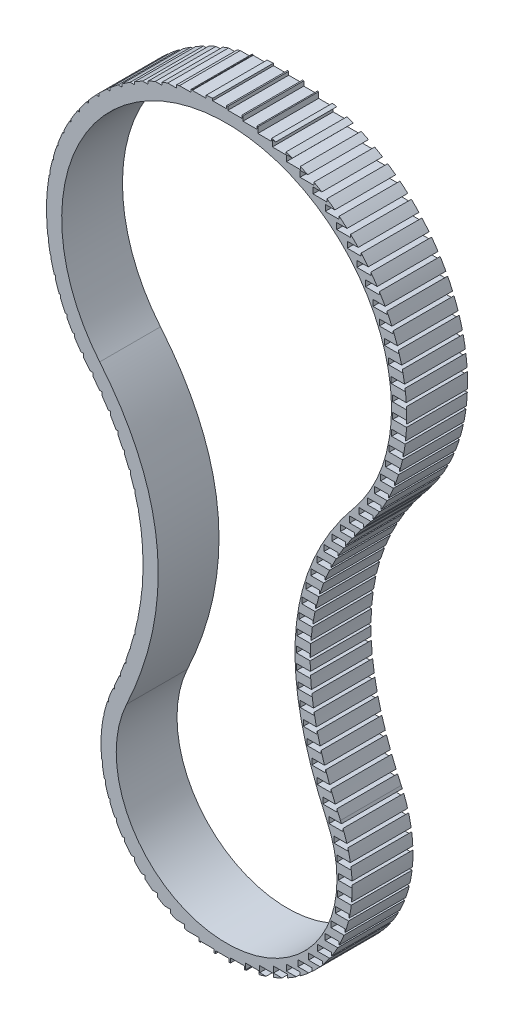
SolidWorks part; units mm, degrees
ref_plane "Front Plane" through (0, 0, 0) normal (0, 0, 1) x (1, 0, 0)
ref_plane "Top Plane" through (0, 0, 0) normal (0, 1, 0) x (1, 0, 0)
ref_plane "Right Plane" through (0, 0, 0) normal (1, 0, 0) x (0, 0, -1)
sketch "Sketch1" plane through (0, 0, 0) normal (0, 0, 1) x (1, 0, 0)
  line L0 (0, 39.9564) -> (0, -40.3579) construction
  arc A0 (20.8817, 25.4998) -> (-20.8817, 25.4998) centre (0, 42.8234) ccw
  arc A1 (-16.4644, -21.0825) -> (16.4644, -21.0825) centre (0, -28.7443) ccw
  arc A2 (22.8058, 23.9036) -> (-22.8058, 23.9036) centre (0, 42.8234) ccw
  arc A3 (-18.731, -20.0277) -> (18.731, -20.0277) centre (0, -28.7443) ccw
  spline S0 degree 3 poles (20.8817, 25.4998) (17.3878, 21.2883) (9.2753, 7.1981) (10.8351, -8.9857) (16.4644, -21.0825) knots 0 0 0 0 0.3135 1 1 1 1
  spline S1 degree 3 poles (-20.8817, 25.4998) (-17.3878, 21.2883) (-9.2753, 7.1981) (-10.8351, -8.9857) (-16.4644, -21.0825) knots 0 0 0 0 0.3135 1 1 1 1
  spline S2 degree 1 poles (-22.8058, 23.9036) (-18.731, -20.0277) knots 0 0 1 1 construction
  spline S3 degree 1 poles (22.8058, 23.9036) (18.731, -20.0277) knots 0 0 1 1 construction
  spline S4 degree 3 poles (-22.8058, 23.9036) (-22.1548, 23.1189) (-20.8863, 21.4875) (-18.6909, 18.2316) (-16.4839, 14.057) (-14.7037, 8.9054) (-13.7671, 3.577) (-13.6735, -1.9566) (-14.3063, -6.7604) (-15.2481, -10.7261) (-16.1739, -13.7611) (-17.1314, -16.3442) (-18.0066, -18.4358) (-18.4863, -19.5019) (-18.731, -20.0277) knots 0 0 0 0 0.0625 0.125 0.25 0.375 0.5 0.625 0.75 0.8125 0.875 0.9375 0.96875 1 1 1 1
  spline S5 degree 3 poles (18.731, -20.0277) (18.4863, -19.5019) (18.0066, -18.4358) (17.1314, -16.3442) (16.1739, -13.7611) (15.2481, -10.7261) (14.3063, -6.7604) (13.6735, -1.9566) (13.7671, 3.577) (14.7037, 8.9054) (16.4839, 14.057) (18.6909, 18.2316) (20.8863, 21.4875) (22.1548, 23.1189) (22.8058, 23.9036) knots 0 0 0 0 0.03125 0.0625 0.125 0.1875 0.25 0.375 0.5 0.625 0.75 0.875 0.9375 1 1 1 1
  dimension "D1" = 2.5
extrude "Boss-Extrude1" add sketch "Sketch1" along normal blind 10
ref_plane "Plane1" through (0, 73, 0) normal (0, 1, 0) x (1, 0, 0)
sketch "Sketch2" plane through (0, 73, 0) normal (0, 1, 0) x (1, 0, 0)
  line L0 (-29.6322, -10) -> (29.6322, -10) construction
  line L1 (0, 0) -> (-2.2841, 0)
  line L2 (0, 0) -> (0, -10)
  line L3 (0, -10) -> (-2.2841, -10)
  line L4 (-2.2841, 0) -> (-2.2841, -10)
extrude "Cut-Extrude1" cut sketch "Sketch2" against normal blind 1
curve "CompCurve1"
curve "CompCurve2"
pattern_curve "CrvPattern2" of "Cut-Extrude1" parameters "D1"=127, "D3"=2.5, "D2"=1, "D4"=10
